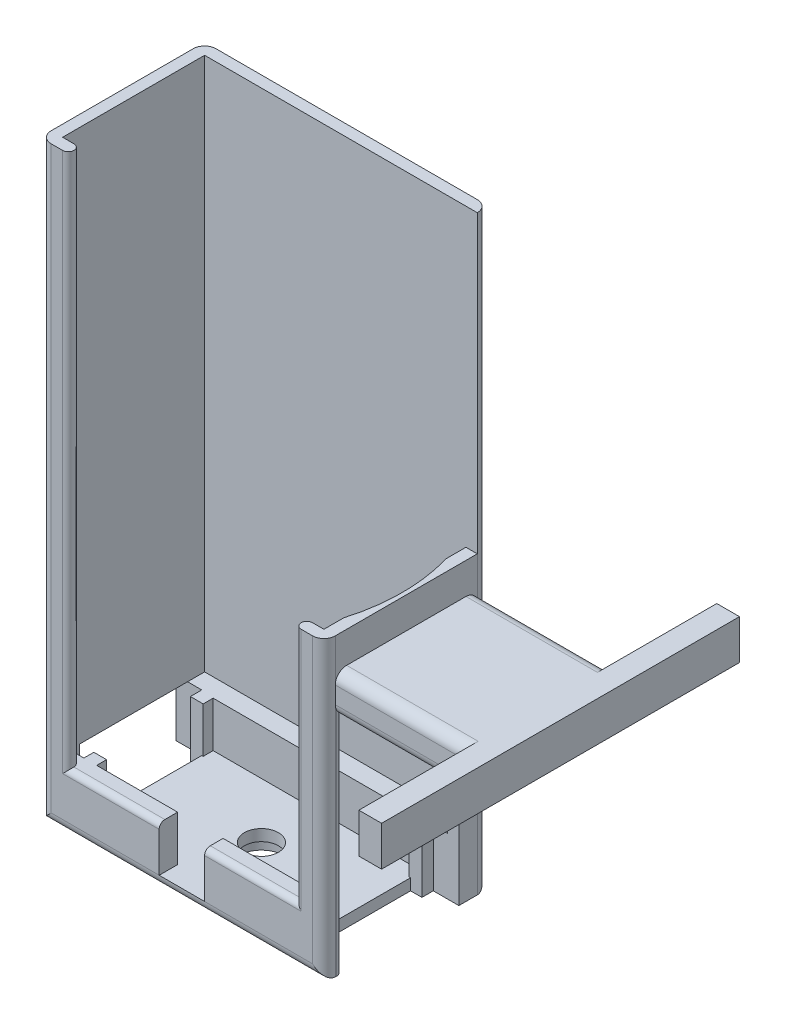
SolidWorks part; units mm, degrees
ref_plane "前视基准面" through (0, 0, 0) normal (0, 0, 1) x (1, 0, 0)
ref_plane "上视基准面" through (0, 0, 0) normal (0, 1, 0) x (1, 0, 0)
ref_plane "右视基准面" through (0, 0, 0) normal (1, 0, 0) x (0, 0, -1)
sketch "草图1" plane through (0, 0, 0) normal (0, 1, 0) x (1, 0, 0)
  line L1 (-44.2839, 1.2903) -> (5.7161, 1.2903)
  line L2 (-44.2839, 1.2903) -> (-44.2839, -0.7097)
  line L3 (-44.2839, -0.7097) -> (5.7161, -0.7097)
  line L4 (5.7161, 1.2903) -> (5.7161, -0.7097)
  dimension "D1" = 2
  dimension "D2" = 50
extrude "凸台-拉伸1" add sketch "草图1" along normal blind 64
sketch "草图2" plane through (0, 0, 0.7097) normal (0, 0, 1) x (1, 0, 0)
  line L5 (5.7161, 64) -> (5.7161, 0) construction
  line L6 (-44.2839, 0) -> (5.7161, 0)
  line L7 (-44.2839, 0) -> (-44.2839, 2)
  line L8 (-44.2839, 2) -> (5.7161, 2)
  line L9 (5.7161, 0) -> (5.7161, 2)
  dimension "D1" = 2
extrude "凸台-拉伸2" add sketch "草图2" along normal blind 27
sketch "草图5" plane through (0, 2, 0) normal (0, 1, 0) x (1, 0, 0)
  line L0 (5.7161, -27.7097) -> (5.7161, -0.7097) construction
  line L1 (-44.2839, -0.7097) -> (5.7161, -0.7097)
  line L2 (-44.2839, -0.7097) -> (-44.2839, -3.9597)
  line L3 (-44.2839, -3.9597) -> (5.7161, -3.9597)
  line L4 (5.7161, -0.7097) -> (5.7161, -3.9597)
  line L5 (-44.2839, -27.7097) -> (-44.2839, -0.7097) construction
  line L6 (5.7161, -27.7097) -> (-44.2839, -27.7097)
  line L7 (5.7161, -27.7097) -> (5.7161, -24.4597)
  line L8 (5.7161, -24.4597) -> (-44.2839, -24.4597)
  line L9 (-44.2839, -27.7097) -> (-44.2839, -24.4597)
  dimension "D1" = 3.25
  dimension "D2" = 3.25
extrude "凸台-拉伸5" add sketch "草图5" along normal blind 8 contours L8 L9 L6 L7 | L3 L4 L1 L2
sketch "草图6" plane through (0, 2, 0) normal (0, 1, 0) x (1, 0, 0)
  line L0 (5.7161, 1.2903) -> (-44.2839, 1.2903) construction
  line L1 (-44.2839, -27.7097) -> (-42.2839, -27.7097)
  line L2 (-44.2839, -27.7097) -> (-44.2839, 1.2903)
  line L3 (-44.2839, 1.2903) -> (-42.2839, 1.2903)
  line L4 (-42.2839, -27.7097) -> (-42.2839, 1.2903)
  line L5 (-44.2839, -27.7097) -> (5.7161, -27.7097) construction
  line L6 (-44.2839, 1.2903) -> (-44.2839, -27.7097) construction
  dimension "D1" = 2
  dimension "D2" = 0
  dimension "D3" = 0
  dimension "D4" = 0
extrude "凸台-拉伸6" add sketch "草图6" along normal blind 62
sketch "草图7" plane through (0, 2, 0) normal (0, 1, 0) x (1, 0, 0)
  line L0 (5.7161, -27.7097) -> (5.7161, 1.2903) construction
  line L1 (5.7161, -27.7097) -> (3.7161, -27.7097)
  line L2 (5.7161, -27.7097) -> (5.7161, 1.2903)
  line L3 (5.7161, 1.2903) -> (3.7161, 1.2903)
  line L4 (3.7161, -27.7097) -> (3.7161, 1.2903)
  line L5 (-44.2839, -27.7097) -> (5.7161, -27.7097) construction
  line L6 (5.7161, 1.2903) -> (-44.2839, 1.2903) construction
  dimension "D1" = 2
  dimension "D2" = 0
  dimension "D3" = 0
  dimension "D4" = 0
extrude "凸台-拉伸7" add sketch "草图7" along normal blind 50
sketch "草图8" plane through (0, 0, 0) normal (0, -1, 0) x (1, 0, 0)
  line L1 (-44.2839, 27.7097) -> (5.7161, 27.7097) construction
  line L2 (5.7161, 27.7097) -> (5.7161, -1.2903) construction
  circle A0 centre (-19.2839, 13.7097) radius 3
  dimension "D1" = 14
  dimension "D2" = 25
extrude "切除-拉伸1" cut sketch "草图8" against normal blind 5
sketch "草图9" plane through (0, 0, 0) normal (0, -1, 0) x (1, 0, 0)
  line L0 (-44.2839, -1.2903) -> (-44.2839, 27.7097) construction
  line L1 (-44.2839, 22.7097) -> (-37.7839, 22.7097)
  line L2 (-44.2839, 22.7097) -> (-44.2839, 3.7097)
  line L3 (-44.2839, 3.7097) -> (-37.7839, 3.7097)
  line L4 (-37.7839, 22.7097) -> (-37.7839, 3.7097)
  line L5 (-44.2839, 27.7097) -> (5.7161, 27.7097) construction
  line L6 (5.7161, -1.2903) -> (-44.2839, -1.2903) construction
  dimension "D1" = 6.5
  dimension "D2" = 5
  dimension "D3" = 5
extrude "切除-拉伸2" cut sketch "草图9" against normal blind 10
sketch "草图10" plane through (0, 0, 0) normal (0, -1, 0) x (1, 0, 0)
  line L0 (5.7161, 27.7097) -> (5.7161, -1.2903) construction
  line L1 (5.7161, 24.4597) -> (-0.7839, 24.4597)
  line L2 (5.7161, 24.4597) -> (5.7161, 3.9597)
  line L3 (5.7161, 3.9597) -> (-0.7839, 3.9597)
  line L4 (-0.7839, 24.4597) -> (-0.7839, 3.9597)
  line L5 (-37.7839, 24.4597) -> (-44.2839, 24.4597) construction
  line L6 (-44.2839, 3.9597) -> (-37.7839, 3.9597) construction
  dimension "D1" = 6.5
  dimension "D2" = 0
  dimension "D3" = 0
extrude "切除-拉伸3" cut sketch "草图10" against normal blind 39.5
sketch "草图11" plane through (-42.2839, 0, 0) normal (1, 0, 0) x (0, 0, -1)
  line L1 (-27.7097, 64) -> (-25.7097, 64)
  line L2 (-27.7097, 64) -> (-27.7097, 10)
  line L3 (-27.7097, 10) -> (-25.7097, 10)
  line L4 (-25.7097, 64) -> (-25.7097, 10)
  dimension "D1" = 2
extrude "凸台-拉伸8" add sketch "草图11" along normal blind 3
sketch "草图12" plane through (3.7161, 0, 0) normal (-1, 0, 0) x (0, 0, 1)
  line L1 (27.7097, 52) -> (25.7097, 52)
  line L2 (27.7097, 52) -> (27.7097, 10)
  line L3 (27.7097, 10) -> (25.7097, 10)
  line L4 (25.7097, 52) -> (25.7097, 10)
  dimension "D1" = 2
extrude "凸台-拉伸9" add sketch "草图12" along normal blind 3
fillet "圆角1" radius 2 6 edges at (5.7161, 26, 27.7097) (-19.2839, 0, 27.7097) (-19.2839, 0, -1.2903) (5.7161, 32, -1.2903) (-44.2839, 32, -1.2903) (-44.2839, 32, 27.7097)
fillet "圆角2" radius 1 6 edges at (-39.2839, 37, 27.7097) (0.7161, 31, 27.7097) (5.7161, 19.75, 24.4597) (-19.2839, 10, 27.7097) (0.7161, 31, 25.7097) (-39.2839, 37, 25.7097)
sketch "草图13" plane through (0, 0, 27.7097) normal (0, 0, 1) x (1, 0, 0)
  line L0 (-42.2839, 2) -> (3.7161, 2) construction
  line L1 (-23.2839, 2) -> (-15.2839, 2)
  line L2 (-23.2839, 2) -> (-23.2839, 10)
  line L3 (-23.2839, 10) -> (-15.2839, 10)
  line L4 (-15.2839, 2) -> (-15.2839, 10)
  line L5 (-42.2839, 10) -> (3.7161, 10) construction
  line L6 (5.7161, 52) -> (5.7161, 0) construction
  dimension "D1" = 8
  dimension "D2" = 21
extrude "切除-拉伸4" cut sketch "草图13" against normal blind 5
sketch "草图14" plane through (5.7161, 0, 0) normal (1, 0, 0) x (0, 0, -1)
  line L0 (-25.7097, 52) -> (-25.7097, 0) construction
  line L1 (-25.7097, 39.5) -> (-0.7097, 39.5)
  line L2 (-25.7097, 39.5) -> (-25.7097, 46.5)
  line L3 (-25.7097, 46.5) -> (-0.7097, 46.5)
  line L4 (-0.7097, 39.5) -> (-0.7097, 46.5)
  line L5 (-0.7097, 0) -> (-0.7097, 52) construction
  line L6 (-3.9597, 0) -> (-0.7097, 0) construction
  dimension "D1" = 39.5
  dimension "D2" = 7
extrude "凸台-拉伸10" add sketch "草图14" along normal blind 23.15
sketch "草图15" plane through (28.8661, 0, 0) normal (1, 0, 0) x (0, 0, -1)
  line L1 (-0.7097, 46.5) -> (-25.7097, 46.5) construction
  line L2 (-44.7097, 39.5) -> (18.2903, 39.5)
  line L3 (-44.7097, 39.5) -> (-44.7097, 46.5)
  line L4 (-44.7097, 46.5) -> (18.2903, 46.5)
  line L5 (18.2903, 39.5) -> (18.2903, 46.5)
  line L6 (-25.7097, 39.5) -> (-0.7097, 39.5) construction
  line L7 (-0.7097, 39.5) -> (-0.7097, 46.5) construction
  line L8 (-25.7097, 46.5) -> (-25.7097, 39.5) construction
  dimension "D1" = 0
  dimension "D2" = 0
  dimension "D3" = 19
  dimension "D4" = 19
extrude "凸台-拉伸11" add sketch "草图15" along normal blind 4
fillet "圆角3" radius 2 4 edges at (17.2911, 39.5, 25.7097) (17.2911, 46.5, 25.7097) (17.2911, 46.5, 0.7097) (17.2911, 39.5, 0.7097)
sketch "草图16" plane through (0, 0, 0) normal (0, -1, 0) x (1, 0, 0)
  circle A0 centre (-19.2839, 13.7097) radius 4
  circle A1 centre (-19.2839, 13.7097) radius 6
  dimension "D1" = 8
extrude "凸台-拉伸12" add sketch "草图16" along normal blind 2
sketch "草图17" plane through (0, 52, 0) normal (0, 1, 0) x (1, 0, 0)
  line L0 (3.7161, -0.7097) -> (3.7161, -25.7097) construction
  line L1 (5.7161, -25.7097) -> (5.7161, -0.7097) construction
  line L2 (-42.2839, -0.7097) -> (5.7161, -0.7097) construction
  line L3 (3.7161, -22.2097) -> (3.7161, -4.2097)
  arc A0 (3.7161, -4.2097) -> (3.7161, -22.2097) centre (-26.7877, -13.2097) cw
  point P3 (5.0161, -13.2097)
  dimension "D1" = 0.7
  dimension "D2" = 18
  dimension "D3" = 3.5
extrude "切除-拉伸5" cut sketch "草图17" against normal blind 22
sketch "草图19" plane through (-37.7839, 0, 0) normal (-1, 0, 0) x (0, 0, 1)
  line L0 (3.9597, 2) -> (22.7097, 2) construction
  line L1 (3.7097, 0) -> (5.7097, 0)
  line L2 (3.7097, 0) -> (3.7097, 2)
  line L3 (3.7097, 2) -> (5.7097, 2)
  line L4 (5.7097, 0) -> (5.7097, 2)
  line L13 (3.7097, 10) -> (3.7097, 0) construction
  dimension "D1" = 0
extrude "凸台-拉伸13" add sketch "草图19" along normal blind 2
sketch "草图20" plane through (-0.7839, 0, 0) normal (1, 0, 0) x (0, 0, -1)
  line L0 (-24.4597, 0) -> (-3.9597, 0) construction
  line L1 (-24.4597, 2) -> (-22.4597, 2)
  line L2 (-24.4597, 2) -> (-24.4597, 0)
  line L3 (-24.4597, 0) -> (-22.4597, 0)
  line L4 (-22.4597, 2) -> (-22.4597, 0)
  line L5 (-24.4597, 2) -> (-3.9597, 2) construction
  line L6 (-3.9597, 0) -> (-5.9597, 0)
  line L7 (-3.9597, 0) -> (-3.9597, 2)
  line L8 (-3.9597, 2) -> (-5.9597, 2)
  line L9 (-5.9597, 0) -> (-5.9597, 2)
  dimension "D1" = 2
  dimension "D2" = 2
extrude "凸台-拉伸14" add sketch "草图20" along normal blind 2
sketch "草图21" plane through (0, 2, 0) normal (0, 1, 0) x (1, 0, 0)
  line L0 (-23.2839, -24.4597) -> (-42.2839, -24.4597) construction
  line L1 (-39.7839, -3.7097) -> (-37.5339, -3.7097)
  line L2 (-39.7839, -3.7097) -> (-39.7839, -5.7097)
  line L3 (-39.7839, -5.7097) -> (-37.5339, -5.7097)
  line L4 (-37.5339, -3.7097) -> (-37.5339, -5.7097)
  line L5 (-39.7839, -22.7097) -> (-37.5339, -22.7097)
  line L6 (-39.7839, -22.7097) -> (-39.7839, -24.4597)
  line L7 (-39.7839, -24.4597) -> (-37.5339, -24.4597)
  line L8 (-37.5339, -22.7097) -> (-37.5339, -24.4597)
  line L9 (-37.7839, -22.7097) -> (-42.2839, -22.7097) construction
  line L10 (1.2161, -3.9597) -> (-1.0339, -3.9597)
  line L11 (1.2161, -3.9597) -> (1.2161, -5.9597)
  line L12 (1.2161, -5.9597) -> (-1.0339, -5.9597)
  line L13 (-1.0339, -3.9597) -> (-1.0339, -5.9597)
  line L14 (1.2161, -22.4597) -> (-1.0339, -22.4597)
  line L15 (1.2161, -22.4597) -> (1.2161, -24.4597)
  line L16 (1.2161, -24.4597) -> (-1.0339, -24.4597)
  line L17 (-1.0339, -22.4597) -> (-1.0339, -24.4597)
  line L19 (-37.7839, -5.7097) -> (-37.7839, -22.7097) construction
  line L20 (-39.7839, -5.7097) -> (-37.7839, -5.7097) construction
  line L21 (-42.2839, -3.7097) -> (-37.7839, -3.7097) construction
  line L23 (-39.7839, -5.7097) -> (-39.7839, -3.7097) construction
  line L24 (1.2161, -5.9597) -> (-0.7839, -5.9597) construction
  line L27 (1.2161, -3.9597) -> (1.2161, -5.9597) construction
  line L28 (-0.7839, -22.4597) -> (-0.7839, -5.9597) construction
  line L29 (1.2161, -24.4597) -> (-15.2839, -24.4597) construction
  dimension "D1" = 0
  dimension "D2" = 0.25
  dimension "D3" = 0
  dimension "D4" = 0
  dimension "D5" = 0
  dimension "D6" = 0
  dimension "D7" = 0.25
  dimension "D8" = 0
  dimension "D9" = 0.25
  dimension "D10" = 0
extrude "凸台-拉伸15" add sketch "草图21" along normal blind 8
sketch "草图22" plane through (0, 0, 0) normal (0, -1, 0) x (1, 0, 0)
  line L0 (5.7161, 25.7097) -> (-44.2839, 25.7097) construction
  line L1 (-37.7519, 25.7097) -> (-0.863, 25.7097)
  line L2 (-37.7519, 25.7097) -> (-37.7519, 0.7097)
  line L3 (-37.7519, 0.7097) -> (-0.863, 0.7097)
  line L4 (-0.863, 25.7097) -> (-0.863, 0.7097)
  line L5 (-44.2839, 0.7097) -> (5.7161, 0.7097) construction
sketch "草图23" plane through (0, 64, 0) normal (0, 1, 0) x (1, 0, 0)
  line L0 (5.7161, -0.7097) -> (-42.2839, -0.7097)
  line L1 (-42.2839, -0.7097) -> (-42.2839, -25.7097)
  line L2 (-42.2839, -25.7097) -> (-40.2839, -25.7097)
  line L3 (-42.2839, 1.2903) -> (3.7161, 1.2903)
  line L4 (-44.2839, -0.7097) -> (-44.2839, -25.7097)
  line L5 (-42.2839, -27.7097) -> (-40.2839, -27.7097)
  arc A0 (-40.2839, -25.7097) -> (-39.2839, -26.7097) centre (-40.2839, -26.7097) cw
  arc A1 (-39.2839, -26.7097) -> (-40.2839, -27.7097) centre (-40.2839, -26.7097) cw
  arc A2 (5.7161, -0.7097) -> (3.7161, 1.2903) centre (3.7161, -0.7097) ccw
  arc A3 (-42.2839, 1.2903) -> (-44.2839, -0.7097) centre (-42.2839, -0.7097) ccw
  arc A4 (-44.2839, -25.7097) -> (-42.2839, -27.7097) centre (-42.2839, -25.7097) ccw
extrude "凸台-拉伸16" add sketch "草图23" along normal blind 40
